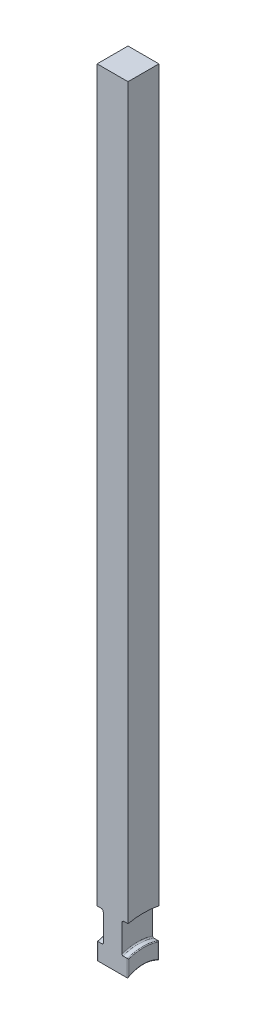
SolidWorks part; units mm, degrees
ref_plane "Front Plane" through (0, 0, 0) normal (0, 0, 1) x (1, 0, 0)
ref_plane "Top Plane" through (0, 0, 0) normal (0, 1, 0) x (1, 0, 0)
ref_plane "Right Plane" through (0, 0, 0) normal (1, 0, 0) x (0, 0, -1)
sketch "Sketch1" plane through (0, 0, 0) normal (1, 0, 0) x (0, 0, -1)
  line L0 (-5, 260) -> (-5, 0)
  line L1 (0, 249.2329) -> (0, 0) construction
  line L2 (5, 260) -> (5, 0)
  line L3 (-5, 260) -> (5, 260)
  line L6 (-5, 0) -> (5, 0)
  arc A0 (-10, 0) -> (10, 0) centre (0, 0) cw construction
  dimension "R" = 10
  dimension "L" = 250
  dimension "T" = 10
extrude "Boss-Extrude1" add sketch "Sketch1" along normal mid plane 10
sketch "Sketch8" plane through (0, 0, 0) normal (1, 0, 0) x (0, 0, -1)
  circle A0 centre (0, 0) radius 10
  arc A1 (10, 0) -> (-10, 0) centre (0, 0) ccw construction
extrude "Cut-Extrude4" cut sketch "Sketch8" against normal through all both and the other way through all
sketch "Sketch2" plane through (0, 0, 0) normal (0, 0, 1) x (1, 0, 0)
  line L0 (5, 15) -> (3, 15)
  line L1 (5, 260) -> (5, 8.6603) construction
  line L2 (3, 15) -> (3, 24.5)
  line L3 (3, 24.5) -> (5, 24.5)
  line L4 (5, 24.5) -> (5, 15)
  line L5 (0, 29.9173) -> (0, 0) construction
  line L6 (-5, 24.5) -> (-5, 15)
  line L7 (-3, 24.5) -> (-5, 24.5)
  line L8 (-3, 15) -> (-3, 24.5)
  line L9 (-5, 15) -> (-3, 15)
  line L10 (-8.8482, 0) -> (24.5305, 0) construction
  dimension "D1" = 6
  dimension "D2" = 24.5
  dimension "D3" = 15
revolve "Cut-Revolve1" cut sketch "Sketch2" angle 360 about L10
fillet "Fillet1" radius 0.762 2 edges at (-3, 24.5, 0) (3, 24.5, 0)
fillet "Fillet2" radius 0.381 2 edges at (-3, 15, 0) (3, 15, 0)
fillet "Fillet3" radius 0.25 8 edges at (5, 11.4012, -5) (5, 10, 0) (5, 11.4012, 5) (5, 15, 0) (-5, 10, 0) (-5, 11.4012, -5) (-5, 15, 0) (-5, 11.4012, 5)
